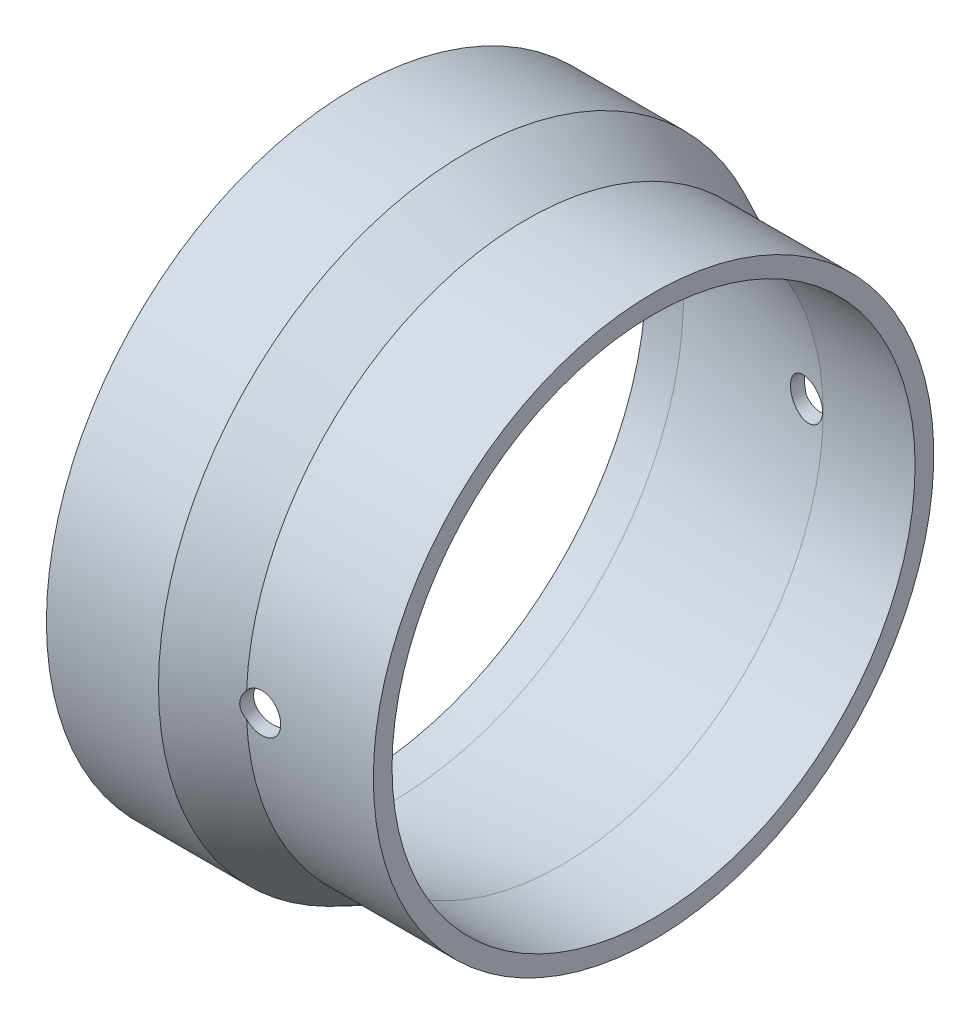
SolidWorks part; units mm, degrees
ref_plane "Front Plane" through (0, 0, 0) normal (0, 0, 1) x (1, 0, 0)
ref_plane "Top Plane" through (0, 0, 0) normal (0, 1, 0) x (1, 0, 0)
ref_plane "Right Plane" through (0, 0, 0) normal (1, 0, 0) x (0, 0, -1)
sketch "Sketch1" plane through (0, 0, 0) normal (0, 0, 1) x (1, 0, 0)
  line L0 (-26.3725, 0) -> (30.8425, 0) construction
  line L1 (0, 26.1937) -> (0, 24.765)
  line L2 (0, 24.765) -> (3.175, 24.765)
  line L3 (3.175, 24.765) -> (17.5801, 22.225)
  line L4 (17.5801, 22.225) -> (25.4, 22.225)
  line L5 (25.4, 22.225) -> (25.4, 23.8125)
  line L6 (25.4, 23.8125) -> (14.605, 23.8125)
  line L7 (14.605, 23.8125) -> (9.525, 26.1937)
  line L8 (9.525, 26.1937) -> (0, 26.1937)
  line L9 (0, 24.765) -> (31.0915, 19.2827) construction
  dimension "D1" = 52.3875
  dimension "D2" = 49.53
  dimension "D3" = 47.625
  dimension "D4" = 44.45
  dimension "D5" = 10
  dimension "D6" = 14.605
  dimension "D7" = 25.4
  dimension "D8" = 9.525
  dimension "D9" = 10
  dimension "D10" = 3.175
revolve "Revolve1" add sketch "Sketch1" angle 360 about L0
sketch "Sketch2" plane through (0, 0, 0) normal (0, 0, 1) x (1, 0, 0)
  line L0 (25.4, -23.8125) -> (25.4, 23.8125) construction
  circle A0 centre (15.875, 0) radius 1.651
  dimension "D1" = 3.302
  dimension "D2" = 9.525
extrude "Cut-Extrude1" cut sketch "Sketch2" against normal through all both and the other way through all
